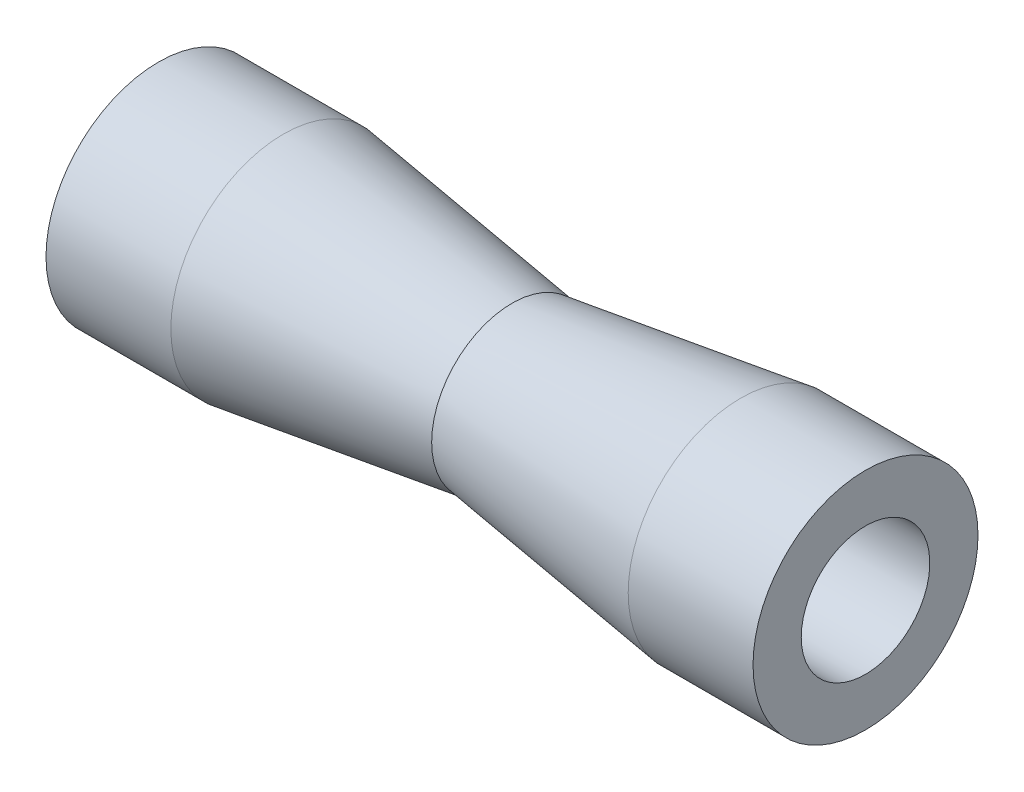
SolidWorks part; units mm, degrees
ref_plane "Front Plane" through (0, 0, 0) normal (0, 0, 1) x (1, 0, 0)
ref_plane "Top Plane" through (0, 0, 0) normal (0, 1, 0) x (1, 0, 0)
ref_plane "Right Plane" through (0, 0, 0) normal (1, 0, 0) x (0, 0, -1)
sketch "Sketch1" plane through (0, 0, 0) normal (0, 0, 1) x (1, 0, 0)
  line L0 (0, 0) -> (58.7816, 0) construction
  line L1 (0, 6.35) -> (69.85, 6.35)
  line L2 (69.85, 6.35) -> (69.85, 11.1125)
  line L3 (69.85, 11.1125) -> (57.5163, 11.1125)
  line L4 (57.5163, 11.1125) -> (34.925, 7.9375)
  line L5 (34.925, 7.9375) -> (12.3337, 11.1125)
  line L6 (12.3337, 11.1125) -> (0, 11.1125)
  line L7 (0, 11.1125) -> (0, 6.35)
  line L8 (34.925, 6.35) -> (34.925, 7.9375) construction
  dimension "D1" = 12.7
  dimension "D2" = 22.225
  dimension "D3" = 69.85
  dimension "D4" = 15.875
  dimension "D5" = 8
  dimension "D6" = 12.3337
revolve "Revolve1" add sketch "Sketch1" angle 360 about L0
